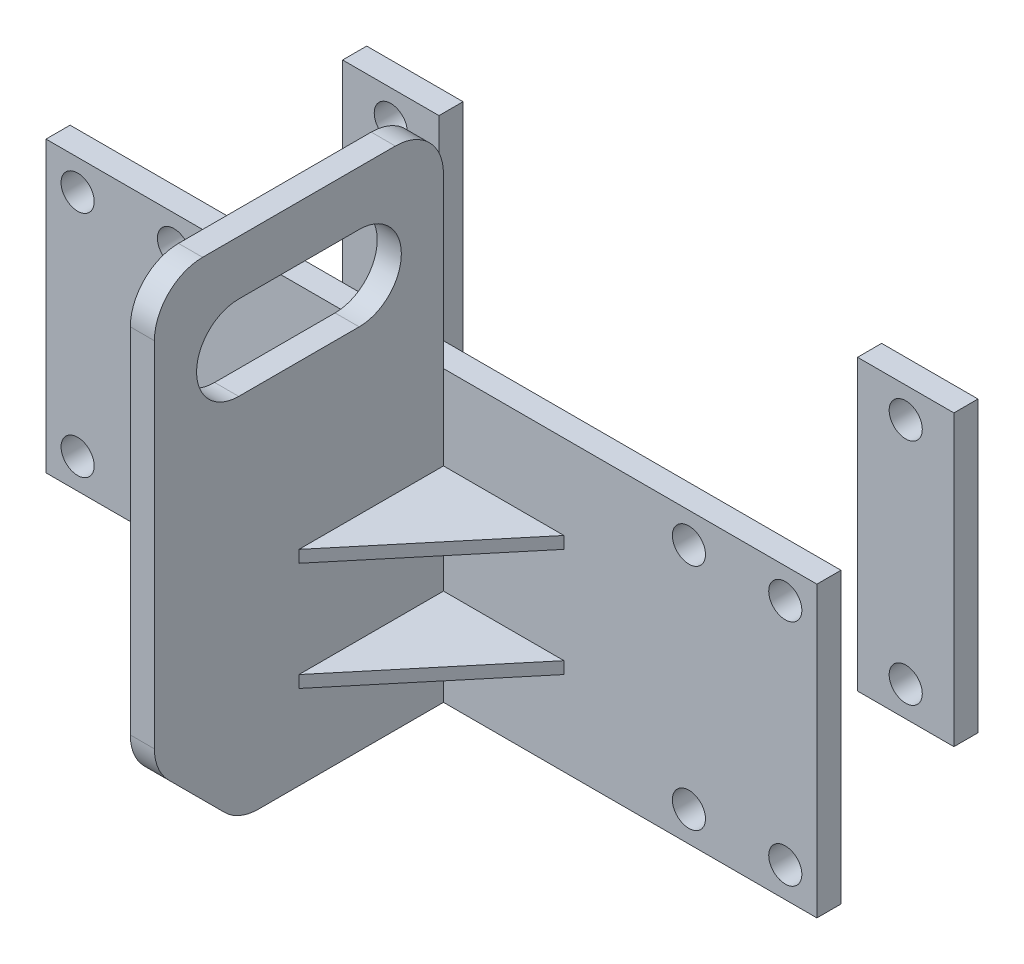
SolidWorks part; units mm, degrees
ref_plane "Face" through (0, 0, 0) normal (0, 0, 1) x (1, 0, 0)
ref_plane "Dessus" through (0, 0, 0) normal (0, 1, 0) x (1, 0, 0)
ref_plane "Droite" through (0, 0, 0) normal (1, 0, 0) x (0, 0, -1)
imported_body "Importée1"
sketch "Esquisse2" plane through (0, -31.75, 0) normal (0, -1, 0) x (1, 0, 0)
  line L0 (-1187.45, 596.9) -> (-1123.95, 520.7)
  line L2 (-1123.95, 520.7) -> (-1187.45, 520.7)
  line L3 (-1187.45, 520.7) -> (-1187.45, 596.9)
  line L4 (-1193.8, 508) -> (-1193.8, 612.8737) construction
  line L5 (-990.6, 508) -> (-1397, 508) construction
  line L6 (-1200.15, 520.7) -> (-1200.15, 596.9)
  line L7 (-1263.65, 520.7) -> (-1200.15, 520.7)
  line L8 (-1200.15, 596.9) -> (-1263.65, 520.7)
  line L9 (-990.6, 520.7) -> (-1187.45, 520.7) construction
  line L10 (-1149.35, 520.7) -> (-1187.45, 520.7) construction
  dimension "D1" = 63.5
  dimension "D2" = 76.2
extrude "Boss.-Extru.1" add sketch "Esquisse2" against normal blind 6.35
mirror "Symétrie1" about plane through (0, 0, 0) normal (0, 1, 0) of "Boss.-Extru.1"
ref_plane "Plane1" through (-1193.8, 0, 0) normal (1, 0, 0) x (0, 0, -1)
ref_plane "Plane2" through (0, 0, 0) normal (0, 1, 0) x (1, 0, 0)
other "Move Face1" parameters "D1"=12.7
other "Move Face2" parameters "D1"=12.7
ref_plane "Plane3" through (0, 0, 406.4) normal (0, 0, -1) x (-1, 0, 0)
sketch "Sketch1" plane through (0, 0, 406.4) normal (0, 0, -1) x (-1, 0, 0)
  line L0 (1397, 76.2) -> (990.6, 76.2) construction
  line L1 (1304.1313, 76.2) -> (1354.9313, 76.2)
  line L2 (1304.1313, 76.2) -> (1304.1313, -76.2)
  line L3 (1304.1313, -76.2) -> (1354.9313, -76.2)
  line L4 (1354.9313, 76.2) -> (1354.9313, -76.2)
  line L5 (990.6, -76.2) -> (1397, -76.2) construction
  line L6 (1304.1313, 76.2) -> (1354.9313, -76.2) construction
  line L7 (1329.5313, 60.325) -> (1329.5313, -60.325) construction
  circle A0 centre (1329.5313, 60.325) radius 8.7313 construction
  circle A1 centre (1329.5313, -60.325) radius 8.7313 construction
  circle A2 centre (1329.5313, 60.325) radius 8.7313
  circle A3 centre (1329.5313, -60.325) radius 8.7313
  point P12 (1329.5313, 0)
  dimension "D1" = 50.8
extrude "Boss-Extrude1" add sketch "Sketch1" along normal blind 12.7 separate body
other "Move Face3" parameters "D1"=25.4
mirror "Mirror1" about plane through (-1193.8, 0, 0) normal (1, 0, 0)
sketch "Sketch3" plane through (-1187.45, 0, 0) normal (1, 0, 0) x (0, 0, -1)
  line L0 (-673.1, 31.75) -> (-673.1, 190.5)
  line L1 (-673.1, 190.5) -> (-520.7, 190.5)
  line L2 (-520.7, 190.5) -> (-520.7, 76.2)
  line L3 (-520.7, 76.2) -> (-508, 76.2) construction
  line L4 (-520.7, 76.2) -> (-520.7, -76.2) construction
  line L5 (-628.65, 76.2) -> (-520.7, 76.2) construction
  line L6 (-673.1, 31.75) -> (-628.65, 76.2)
  line L7 (-628.65, 76.2) -> (-673.1, 31.75) construction
  line L8 (-628.65, 76.2) -> (-520.7, 76.2)
  dimension "D1" = 90
  dimension "D2" = 114.3
extrude "Boss-Extrude3" add sketch "Sketch3" against normal up to vertex
other "Move Face4" parameters "D1"=139.7
fillet "Fillet1" radius 25.4 4 edges at (-1193.8, -76.2, 628.65) (-1193.8, -31.75, 673.1) (-1193.8, 190.5, 673.1) (-1193.8, 190.5, 520.7)
